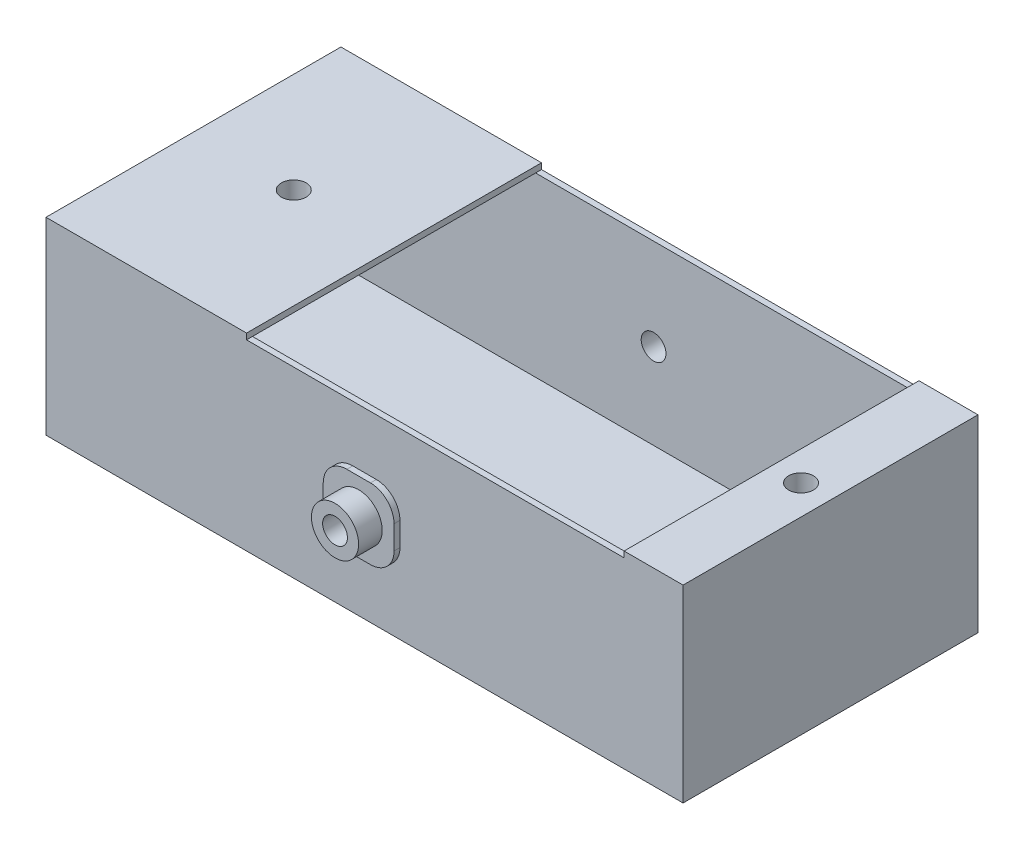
SolidWorks part; units mm, degrees
ref_plane "Front Plane" through (0, 0, 0) normal (0, 0, 1) x (1, 0, 0)
ref_plane "Top Plane" through (0, 0, 0) normal (0, 1, 0) x (1, 0, 0)
ref_plane "Right Plane" through (0, 0, 0) normal (1, 0, 0) x (0, 0, -1)
sketch "Sketch1" plane through (0, 0, 0) normal (0, 1, 0) x (1, 0, 0)
  line L1 (270, -125) -> (-270, -125)
  line L2 (270, -125) -> (270, 125)
  line L3 (270, 125) -> (-270, 125)
  line L4 (-270, -125) -> (-270, 125)
  line L5 (270, -125) -> (-270, 125) construction
  line L6 (270, 125) -> (-270, -125) construction
  point P0 (0, 0)
  dimension "D1" = 250
  dimension "D2" = 540
extrude "Boss-Extrude1" add sketch "Sketch1" along normal blind 5
sketch "Sketch2" plane through (0, 5, 0) normal (0, 1, 0) x (1, 0, 0)
  line L0 (-270, -125) -> (270, -125) construction
  line L1 (270, -125) -> (270, 125) construction
  line L2 (-270, 125) -> (-270, -125) construction
  line L3 (270, 125) -> (-270, 125) construction
  line L4 (-270, -125) -> (270, -125)
  line L5 (270, -125) -> (270, 125)
  line L6 (-270, 125) -> (-270, -125)
  line L7 (270, 125) -> (-270, 125)
  line L8 (265, 120) -> (-265, 120)
  line L9 (-265, 120) -> (-265, -120)
  line L10 (-265, -120) -> (265, -120)
  line L11 (265, -120) -> (265, 120)
  dimension "D1" = 5
extrude "Boss-Extrude2" add sketch "Sketch2" along normal blind 150
sketch "Sketch3" plane through (0, 155, 0) normal (0, 1, 0) x (1, 0, 0)
  line L0 (-270, -125) -> (270, -125) construction
  line L1 (-270, 125) -> (-100, 125)
  line L2 (-270, 125) -> (-270, -125)
  line L3 (-270, -125) -> (-100, -125)
  line L4 (-100, 125) -> (-100, -125)
  line L5 (-270, 125) -> (-100, -125) construction
  line L6 (-270, -125) -> (-100, 125) construction
  line L8 (270, 125) -> (220, 125)
  line L9 (270, 125) -> (270, -125)
  line L10 (270, -125) -> (220, -125)
  line L11 (220, 125) -> (220, -125)
  line L12 (270, 125) -> (220, -125) construction
  line L13 (270, -125) -> (220, 125) construction
  circle A0 centre (-185, 0) radius 10.5
  circle A1 centre (245, 0) radius 10.5
  point P4 (-185, 0)
  point P12 (245, 0)
extrude "Boss-Extrude3" add sketch "Sketch3" along normal blind 5
sketch "Sketch4" plane through (0, 0, 125) normal (0, 0, 1) x (1, 0, 0)
  line L0 (0, 0) -> (0, 155) construction
  line L1 (-100, 155) -> (220, 155) construction
  circle A0 centre (0, 77.5) radius 10.5
  circle A1 centre (0, 77.5) radius 20
extrude "Boss-Extrude4" add sketch "Sketch4" along normal blind 25
sketch "Sketch5" plane through (0, 0, 125) normal (0, 0, 1) x (1, 0, 0)
  line L1 (30, 47.5) -> (-30, 47.5)
  line L2 (30, 47.5) -> (30, 107.5)
  line L3 (30, 107.5) -> (-30, 107.5)
  line L4 (-30, 47.5) -> (-30, 107.5)
  line L5 (30, 47.5) -> (-30, 107.5) construction
  line L6 (30, 107.5) -> (-30, 47.5) construction
  point P0 (0, 77.5)
  dimension "D1" = 60
  dimension "D2" = 60
extrude "Boss-Extrude5" add sketch "Sketch5" along normal blind 5
fillet "Fillet1" radius 20 4 edges at (-30, 47.5, 127.5) (-30, 107.5, 127.5) (30, 47.5, 127.5) (30, 107.5, 127.5)
mirror "Mirror1" about plane through (0, 0, 0) normal (0, 0, 1) of "Boss-Extrude5", "Boss-Extrude4"
fillet "Fillet2" radius 20 4 edges at (30, 47.5, -127.5) (-30, 47.5, -127.5) (30, 107.5, -127.5) (-30, 107.5, -127.5)
sketch "Sketch6" plane through (0, 0, -130) normal (0, 0, -1) x (-1, 0, 0)
  circle A0 centre (0, 77.5) radius 10.5
extrude "Cut-Extrude1" cut sketch "Sketch6" against normal through all
sketch "Sketch7" plane through (0, 160, 0) normal (0, 1, 0) x (1, 0, 0)
  circle A0 centre (-185, 0) radius 20
  circle A1 centre (-185, 0) radius 10.5
extrude "Boss-Extrude6" add sketch "Sketch7" against normal blind 30
sketch "Sketch8" plane through (0, 160, 0) normal (0, 1, 0) x (1, 0, 0)
  line L1 (-155, -30) -> (-215, -30)
  line L2 (-155, -30) -> (-155, 30)
  line L3 (-155, 30) -> (-215, 30)
  line L4 (-215, -30) -> (-215, 30)
  line L5 (-155, -30) -> (-215, 30) construction
  line L6 (-155, 30) -> (-215, -30) construction
  circle A0 centre (-185, 0) radius 10.5
  point P0 (-185, 0)
  dimension "D1" = 60
  dimension "D2" = 60
extrude "Boss-Extrude8" add sketch "Sketch8" against normal blind 10
sketch "Sketch9" plane through (0, 160, 0) normal (0, 1, 0) x (1, 0, 0)
  line L1 (260, -25) -> (230, -25)
  line L2 (260, -25) -> (260, 25)
  line L3 (260, 25) -> (230, 25)
  line L4 (230, -25) -> (230, 25)
  line L5 (260, -25) -> (230, 25) construction
  line L6 (260, 25) -> (230, -25) construction
  circle A0 centre (245, 0) radius 10.5
  dimension "D1" = 50
  dimension "D2" = 30
extrude "Boss-Extrude9" add sketch "Sketch9" against normal blind 25
fillet "Fillet3" radius 5 6 edges at (-155, 152.5, 30) (-155, 152.5, -30) (260, 145, -25) (260, 145, 25) (230, 145, 25) (230, 145, -25)
